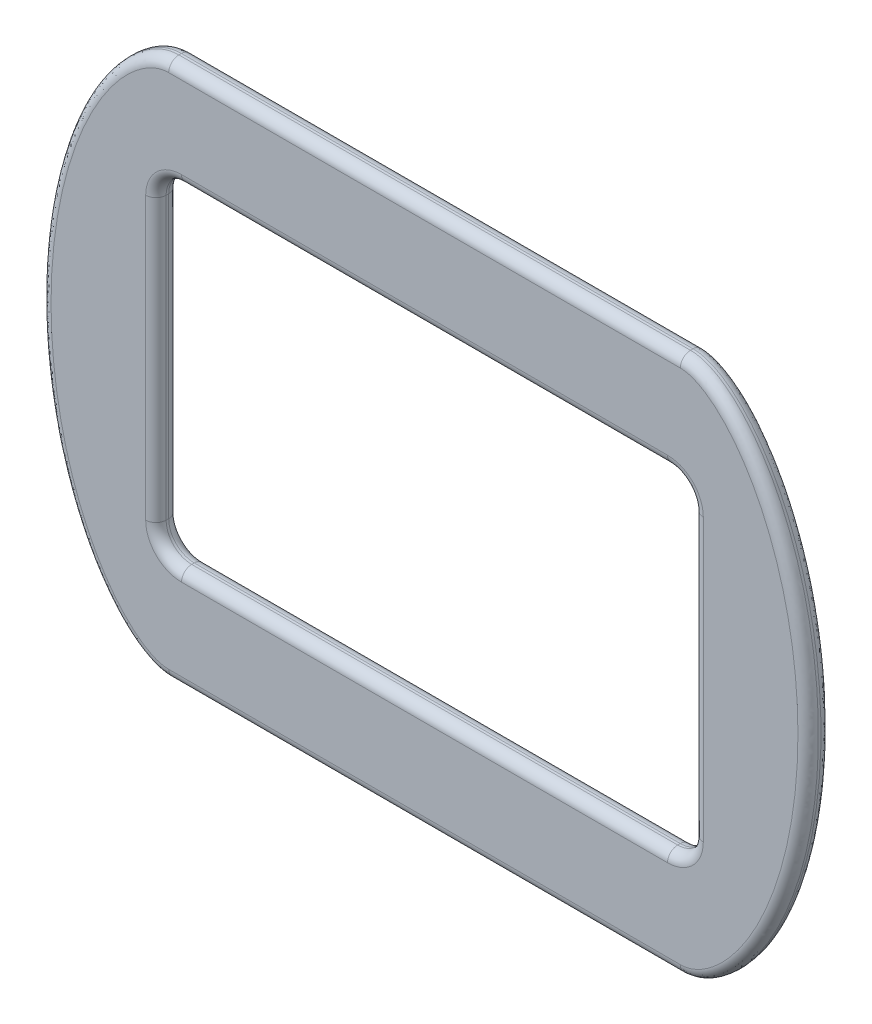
SolidWorks part; units mm, degrees
ref_plane "Plan de face" through (0, 0, 0) normal (0, 0, 1) x (1, 0, 0)
ref_plane "Plan de dessus" through (0, 0, 0) normal (0, 1, 0) x (1, 0, 0)
ref_plane "Plan de droite" through (0, 0, 0) normal (1, 0, 0) x (0, 0, -1)
sketch "Esquisse1" plane through (0, 0, 0) normal (0, 0, 1) x (1, 0, 0)
  line L2 (-9.5, -6.5) -> (9.5, -6.5) construction
  line L3 (-10.5, 5.5) -> (-10.5, -5.5) construction
  line L4 (-10, -10.5) -> (10, -10.5)
  line L5 (10, 10.5) -> (-10, 10.5)
  line L6 (-10, -10.5) -> (10, -10.5)
  line L7 (10, 10.5) -> (-10, 10.5)
  line L8 (9.5, 6.5) -> (-9.5, 6.5) construction
  line L9 (10.5, -5.5) -> (10.5, 5.5) construction
  line L10 (-9.5, -6.5) -> (9.5, -6.5)
  line L11 (-10.5, 5.5) -> (-10.5, -5.5)
  line L12 (9.5, 6.5) -> (-9.5, 6.5)
  line L13 (10.5, -5.5) -> (10.5, 5.5)
  arc A0 (-10.5, -5.5) -> (-9.5, -6.5) centre (-9.5, -5.5) ccw construction
  arc A1 (-9.5, 6.5) -> (-10.5, 5.5) centre (-9.5, 5.5) ccw construction
  arc A2 (10.5, 5.5) -> (9.5, 6.5) centre (9.5, 5.5) ccw construction
  arc A3 (9.5, -6.5) -> (10.5, -5.5) centre (9.5, -5.5) ccw construction
  arc A4 (-10.5, -5.5) -> (-9.5, -6.5) centre (-9.5, -5.5) ccw
  arc A5 (-9.5, 6.5) -> (-10.5, 5.5) centre (-9.5, 5.5) ccw
  arc A6 (10.5, 5.5) -> (9.5, 6.5) centre (9.5, 5.5) ccw
  arc A7 (9.5, -6.5) -> (10.5, -5.5) centre (9.5, -5.5) ccw
  spline S0 degree 3 poles (-10, 10.5) (-10.1326, 10.5) (-10.262, 10.4833) (-10.5156, 10.4229) (-10.641, 10.379) (-11.0006, 10.2206) (-11.2208, 10.0814) (-11.6378, 9.7625) (-11.8296, 9.5857) (-12.188, 9.2109) (-12.355, 9.0123) (-12.6698, 8.5973) (-12.8176, 8.3807) (-13.0923, 7.9402) (-13.2199, 7.7154) (-13.5786, 7.0291) (-13.7854, 6.5562) (-14.1474, 5.5857) (-14.3025, 5.0866) (-14.5619, 4.0864) (-14.6672, 3.5829) (-14.9182, 2.0633) (-14.9999, 1.0381) (-15, -0.5168) (-14.9792, -1.0359) (-14.8962, -2.0627) (-14.8342, -2.5723) (-14.5835, -4.0894) (-14.3332, -5.0855) (-13.7886, -6.5487) (-13.58, -7.0265) (-13.098, -7.9486) (-12.8238, -8.3943) (-12.3567, -9.0101) (-12.1912, -9.2072) (-11.8351, -9.5803) (-11.6447, -9.7566) (-11.2264, -10.0777) (-11.0052, -10.2182) (-10.643, -10.3783) (-10.5188, -10.422) (-10.2645, -10.4829) (-10.1327, -10.5) (-10, -10.5) knots 0 0 0 0 0.015625 0.015625 0.03125 0.03125 0.0625 0.0625 0.09375 0.09375 0.125 0.125 0.15625 0.15625 0.1875 0.1875 0.25 0.25 0.3125 0.3125 0.375 0.375 0.5 0.5 0.5625 0.5625 0.625 0.625 0.75 0.75 0.8125 0.8125 0.875 0.875 0.90625 0.90625 0.9375 0.9375 0.96875 0.96875 0.984375 0.984375 1 1 1 1
  spline S1 degree 3 poles (10, -10.5) (10.1326, -10.5) (10.262, -10.4833) (10.5156, -10.4229) (10.641, -10.379) (11.0006, -10.2206) (11.2208, -10.0814) (11.6378, -9.7625) (11.8296, -9.5857) (12.188, -9.2109) (12.355, -9.0123) (12.6698, -8.5973) (12.8176, -8.3807) (13.0923, -7.9402) (13.2199, -7.7154) (13.5786, -7.0291) (13.7854, -6.5562) (14.1474, -5.5857) (14.3025, -5.0866) (14.5619, -4.0864) (14.6672, -3.5829) (14.9182, -2.0633) (14.9999, -1.0381) (15, 0.5168) (14.9792, 1.0359) (14.8962, 2.0627) (14.8342, 2.5723) (14.5835, 4.0894) (14.3332, 5.0855) (13.7886, 6.5487) (13.58, 7.0265) (13.098, 7.9486) (12.8238, 8.3943) (12.3567, 9.0101) (12.1912, 9.2072) (11.8351, 9.5803) (11.6447, 9.7566) (11.2264, 10.0777) (11.0052, 10.2182) (10.643, 10.3783) (10.5188, 10.422) (10.2645, 10.4829) (10.1327, 10.5) (10, 10.5) knots 0 0 0 0 0.015625 0.015625 0.03125 0.03125 0.0625 0.0625 0.09375 0.09375 0.125 0.125 0.15625 0.15625 0.1875 0.1875 0.25 0.25 0.3125 0.3125 0.375 0.375 0.5 0.5 0.5625 0.5625 0.625 0.625 0.75 0.75 0.8125 0.8125 0.875 0.875 0.90625 0.90625 0.9375 0.9375 0.96875 0.96875 0.984375 0.984375 1 1 1 1
  spline S2 degree 3 poles (-10, 10.5) (-10.1326, 10.5) (-10.262, 10.4833) (-10.5156, 10.4229) (-10.641, 10.379) (-11.0006, 10.2206) (-11.2208, 10.0814) (-11.6378, 9.7625) (-11.8296, 9.5857) (-12.188, 9.2109) (-12.355, 9.0123) (-12.6698, 8.5973) (-12.8176, 8.3807) (-13.0923, 7.9402) (-13.2199, 7.7154) (-13.5786, 7.0291) (-13.7854, 6.5562) (-14.1474, 5.5857) (-14.3025, 5.0866) (-14.5619, 4.0864) (-14.6672, 3.5829) (-14.9182, 2.0633) (-14.9999, 1.0381) (-15, -0.5168) (-14.9792, -1.0359) (-14.8962, -2.0627) (-14.8342, -2.5723) (-14.5835, -4.0894) (-14.3332, -5.0855) (-13.7886, -6.5487) (-13.58, -7.0265) (-13.098, -7.9486) (-12.8238, -8.3943) (-12.3567, -9.0101) (-12.1912, -9.2072) (-11.8351, -9.5803) (-11.6447, -9.7566) (-11.2264, -10.0777) (-11.0052, -10.2182) (-10.643, -10.3783) (-10.5188, -10.422) (-10.2645, -10.4829) (-10.1327, -10.5) (-10, -10.5) knots 0 0 0 0 0.015625 0.015625 0.03125 0.03125 0.0625 0.0625 0.09375 0.09375 0.125 0.125 0.15625 0.15625 0.1875 0.1875 0.25 0.25 0.3125 0.3125 0.375 0.375 0.5 0.5 0.5625 0.5625 0.625 0.625 0.75 0.75 0.8125 0.8125 0.875 0.875 0.90625 0.90625 0.9375 0.9375 0.96875 0.96875 0.984375 0.984375 1 1 1 1
  spline S3 degree 3 poles (10, -10.5) (10.1326, -10.5) (10.262, -10.4833) (10.5156, -10.4229) (10.641, -10.379) (11.0006, -10.2206) (11.2208, -10.0814) (11.6378, -9.7625) (11.8296, -9.5857) (12.188, -9.2109) (12.355, -9.0123) (12.6698, -8.5973) (12.8176, -8.3807) (13.0923, -7.9402) (13.2199, -7.7154) (13.5786, -7.0291) (13.7854, -6.5562) (14.1474, -5.5857) (14.3025, -5.0866) (14.5619, -4.0864) (14.6672, -3.5829) (14.9182, -2.0633) (14.9999, -1.0381) (15, 0.5168) (14.9792, 1.0359) (14.8962, 2.0627) (14.8342, 2.5723) (14.5835, 4.0894) (14.3332, 5.0855) (13.7886, 6.5487) (13.58, 7.0265) (13.098, 7.9486) (12.8238, 8.3943) (12.3567, 9.0101) (12.1912, 9.2072) (11.8351, 9.5803) (11.6447, 9.7566) (11.2264, 10.0777) (11.0052, 10.2182) (10.643, 10.3783) (10.5188, 10.422) (10.2645, 10.4829) (10.1327, 10.5) (10, 10.5) knots 0 0 0 0 0.015625 0.015625 0.03125 0.03125 0.0625 0.0625 0.09375 0.09375 0.125 0.125 0.15625 0.15625 0.1875 0.1875 0.25 0.25 0.3125 0.3125 0.375 0.375 0.5 0.5 0.5625 0.5625 0.625 0.625 0.75 0.75 0.8125 0.8125 0.875 0.875 0.90625 0.90625 0.9375 0.9375 0.96875 0.96875 0.984375 0.984375 1 1 1 1
  dimension "D1" = 4
extrude "Extrusion1" add sketch "Esquisse1" along normal blind 0.9
fillet "Congé1" radius 0.4 28 edges at (-10.2071, -6.2071, 0) (0, -6.5, 0) (10.2071, -6.2071, 0) (10.5, 0, 0) (10.2071, 6.2071, 0) (0, 6.5, 0) (-10.2071, 6.2071, 0) (-10.5, 0, 0) (-10.2071, -6.2071, 0.9) (0, -6.5, 0.9) (10.2071, -6.2071, 0.9) (10.5, 0, 0.9) (10.2071, 6.2071, 0.9) (0, 6.5, 0.9) (-10.2071, 6.2071, 0.9) (-10.5, 0, 0.9)
